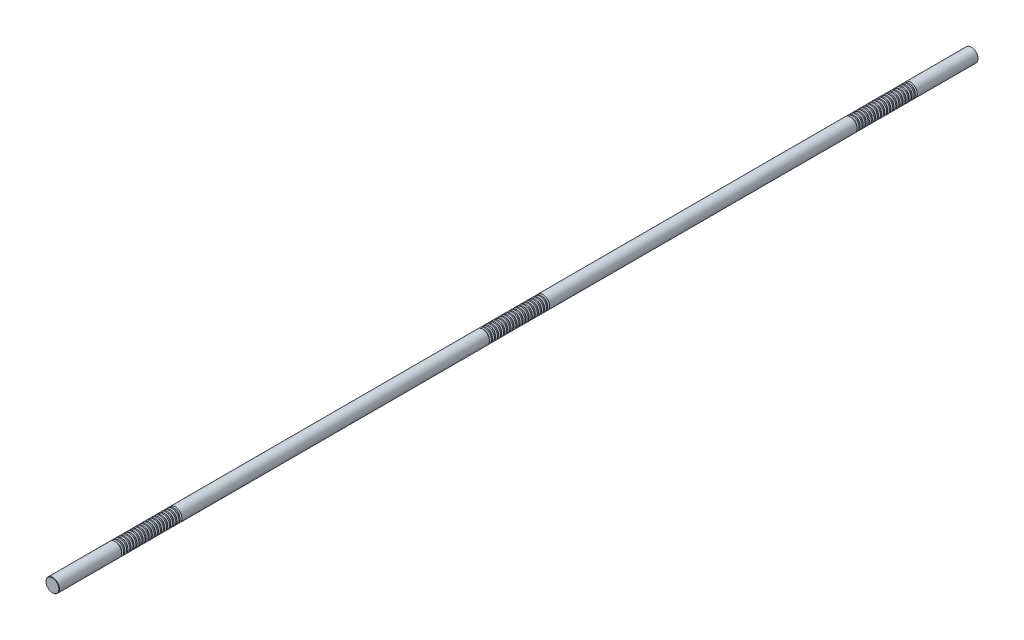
SolidWorks part; units mm, degrees
ref_plane "Front Plane" through (0, 0, 0) normal (0, 0, 1) x (1, 0, 0)
ref_plane "Top Plane" through (0, 0, 0) normal (0, 1, 0) x (1, 0, 0)
ref_plane "Right Plane" through (0, 0, 0) normal (1, 0, 0) x (0, 0, -1)
sketch "Sketch1" plane through (0, 0, 0) normal (0, 0, 1) x (1, 0, 0)
  circle A0 centre (0, 0) radius 11
  dimension "D1" = 22
extrude "Boss-Extrude1" add sketch "Sketch1" along normal mid plane 1500
chamfer "Chamfer1" distance 0.55 angle 45 2 edges at (11, 0, -750) (11, 0, 750)
sketch "Sketch2" plane through (0, 0, 0) normal (1, 0, 0) x (0, 0, -1)
  line L0 (650.3684, 11) -> (647.1316, 11)
  line L1 (749.45, 11) -> (-749.45, 11) construction
  line L2 (647.1316, 11) -> (647.8684, 8.25)
  line L3 (647.8684, 8.25) -> (649.6316, 8.25)
  line L4 (649.6316, 8.25) -> (650.3684, 11)
  line L5 (750, -10.45) -> (750, 10.45) construction
  point P4 (648.75, 11)
  point P7 (648.75, 8.25)
  point P8 (650, 9.625)
  point P9 (647.5, 9.625)
  dimension "D1" = 2.5
  dimension "D2" = 100
  dimension "D3" = 2.75
  dimension "D4" = 30
revolve "Cut-Revolve1" cut sketch "Sketch2" angle 360 about axis through (0, 0, 750) along (0, 0, -1)
pattern_linear "LPattern1" count 20 spacing 5 along (0, 0, 1) of "Cut-Revolve1"
pattern_linear "LPattern2" count 3 spacing 600 along (0, 0, 1) of "Cut-Revolve1", "LPattern1"
